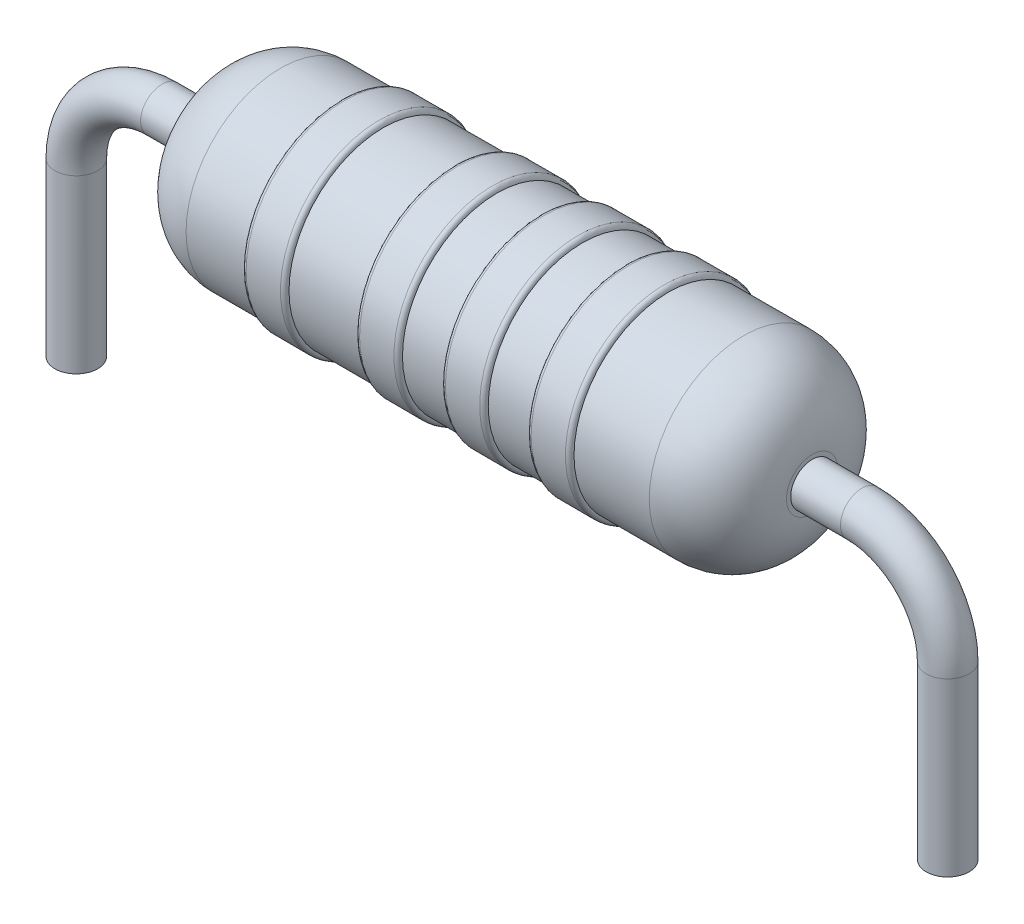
SolidWorks part; units mm, degrees
ref_plane "Face" through (0, 0, 0) normal (0, 0, 1) x (1, 0, 0)
ref_plane "Dessus" through (0, 0, 0) normal (0, 1, 0) x (1, 0, 0)
ref_plane "Droite" through (0, 0, 0) normal (1, 0, 0) x (0, 0, -1)
sketch "Esquisse1" plane through (0, 0, 0) normal (0, 0, 1) x (1, 0, 0)
  line L0 (-54.2687, 0) -> (62.1733, 0) construction
  line L1 (-48.4922, 1.1) -> (45.7559, 1.1) construction
  line L2 (-3.5, -1.6411) -> (-3.5, 4.3175) construction
  line L3 (0, -1.0268) -> (0, 4.1947) construction
  line L4 (3.5, 3.6009) -> (3.5, -1.9687) construction
  line L5 (-3.5, 0) -> (-3.5, 0.3)
  line L6 (-2.7, 1.1) -> (2.7, 1.1)
  line L7 (3.5, 0.3) -> (3.5, 0)
  line L8 (3.5, 0) -> (-3.5, 0)
  arc A0 (-2.7, 1.1) -> (-3.5, 0.3) centre (-2.7, 0.3) ccw
  arc A1 (3.5, 0.3) -> (2.7, 1.1) centre (2.7, 0.3) ccw
revolve "Base-Révolution" add sketch "Esquisse1" angle 360 about L0
sketch "Esquisse2" plane through (0, 0, 0) normal (0, 0, 1) x (1, 0, 0)
  line L0 (-3.3896, 1.15) -> (3.161, 1.15) construction
  line L1 (-2, 1.3889) -> (-2, -0.1179) construction
  line L2 (-1.5, 1.4925) -> (-1.5, -0.2136) construction
  line L3 (4.3262, 0) -> (-3.8651, 0) construction
  line L4 (1.323, 0) -> (1.823, 0)
  line L5 (0.323, 0) -> (0.823, 0)
  line L6 (-0.677, 1.15) -> (-0.677, 0)
  line L7 (0.323, 1.15) -> (0.323, 0)
  line L8 (1.323, 1.15) -> (1.323, 0)
  line L9 (-0.177, 1.15) -> (-0.177, 0)
  line L10 (0.823, 1.15) -> (0.823, 0)
  line L11 (1.823, 1.15) -> (1.823, 0)
  line L12 (-0.677, 0) -> (-0.177, 0)
  line L13 (-0.677, 1.15) -> (-0.177, 1.15)
  line L14 (0.323, 1.15) -> (0.823, 1.15)
  line L15 (1.323, 1.15) -> (1.823, 1.15)
  line L16 (-2, 1.15) -> (-1.5, 1.15)
  line L17 (-1.5, 1.15) -> (-1.5, 0)
  line L18 (-1.5, 0) -> (-2, 0)
  line L19 (-2, 0) -> (-2, 1.15)
revolve "Boss.-Révol.1" add sketch "Esquisse2" angle 360 about L3
fillet "Congé1" radius 0.05 8 edges at (-0.177, 0, -1.15) (-0.677, 0, -1.15) (0.823, 0, -1.15) (0.323, 0, -1.15) (1.823, 0, -1.15) (1.323, 0, -1.15) (-1.5, 0, -1.15) (-2, 0, -1.15)
sketch "Esquisse3" plane through (-3.5, 0, 0) normal (-1, 0, 0) x (0, 0, 1)
  circle A0 centre (0, 0) radius 0.25
sketch "Esquisse4" plane through (0, 0, 0) normal (0, 0, 1) x (1, 0, 0)
  line L0 (-3.1075, 0) -> (-5.8186, 0) construction
  line L1 (0, -2.524) -> (0, 3.2043) construction
  line L2 (-5.9326, -3) -> (3.6667, -3) construction
  line L3 (-5.08, 1.6795) -> (-5.08, -3.4934) construction
  line L4 (-3.5, 0) -> (-4.08, 0)
  line L5 (-5.08, -3) -> (-5.08, -1)
  arc A0 (-4.08, 0) -> (-5.08, -1) centre (-4.08, -1) ccw
  dimension "D3" = 1
  dimension "D1" = 3
  dimension "D2" = 5.08
sweep "Balayage1" add profiles "Esquisse3" path "Esquisse4"
ref_plane "Plan1" through (0, 0, 0) normal (1, 0, 0) x (0, 0, -1)
mirror "Symétrie1" about plane through (0, 0, 0) normal (1, 0, 0) of "Balayage1"
